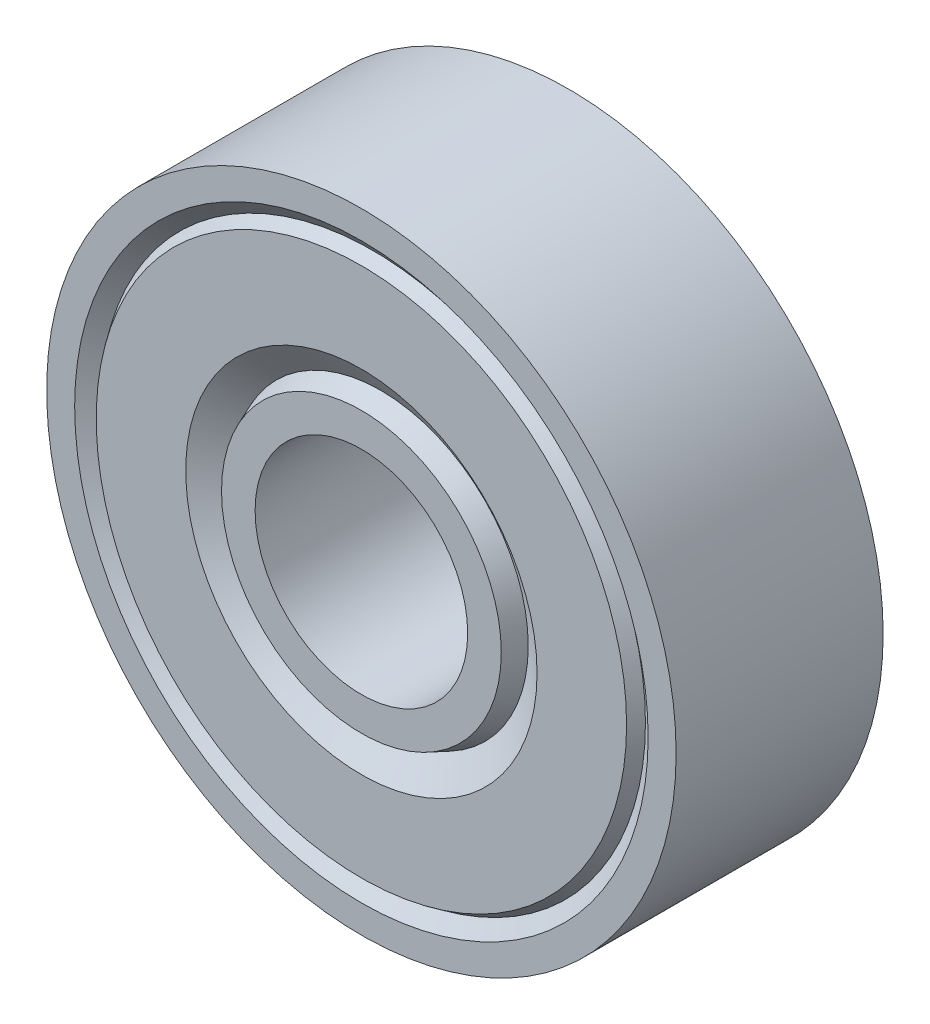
SolidWorks part; units mm, degrees
ref_plane "Front Plane" through (0, 0, 0) normal (0, 0, 1) x (1, 0, 0)
ref_plane "Top Plane" through (0, 0, 0) normal (0, 1, 0) x (1, 0, 0)
ref_plane "Right Plane" through (0, 0, 0) normal (1, 0, 0) x (0, 0, -1)
sketch "Sketch1" plane through (0, 0, 0) normal (0, 1, 0) x (1, 0, 0)
  line L0 (0, 0) -> (0, 6.7224) construction
  line L1 (-6.35, 4.699) -> (-4.826, 4.699)
  line L2 (-6.7014, 3.8258) -> (-6.35, 4.699)
  line L3 (-7.9747, 4.699) -> (-6.7014, 3.8258)
  line L4 (-12.0387, 4.699) -> (-7.9747, 4.699)
  line L5 (-12.387, 4.191) -> (-12.0387, 4.699)
  line L6 (-13.0175, 4.699) -> (-12.387, 4.191)
  line L7 (-14.2875, 4.699) -> (-13.0175, 4.699)
  line L9 (-14.2875, 4.699) -> (-14.2875, -4.699)
  line L10 (-14.2875, -4.699) -> (-13.0175, -4.699)
  line L11 (-13.0175, -4.699) -> (-12.387, -4.191)
  line L12 (-12.387, -4.191) -> (-12.0387, -4.699)
  line L13 (-12.0387, -4.699) -> (-7.9747, -4.699)
  line L14 (-7.9747, -4.699) -> (-6.7014, -3.8258)
  line L15 (-6.7014, -3.8258) -> (-6.35, -4.699)
  line L16 (-6.35, -4.699) -> (-4.826, -4.699)
  line L18 (-4.826, -4.699) -> (-4.826, 4.699)
  line L19 (-14.2875, 0) -> (-4.826, 0) construction
  dimension "D1" = 4.699
  dimension "D2" = 0.8732
  dimension "D3" = 85.58
  dimension "D4" = 0.508
  dimension "D5" = 0.9788
  dimension "D6" = 1.27
  dimension "D7" = 77.48
  dimension "D8" = 9.4615
  dimension "D9" = 9.652
  dimension "D10" = 1.524
  dimension "D11" = 1.6247
revolve "Revolve1" add sketch "Sketch1" angle 360 about L0
